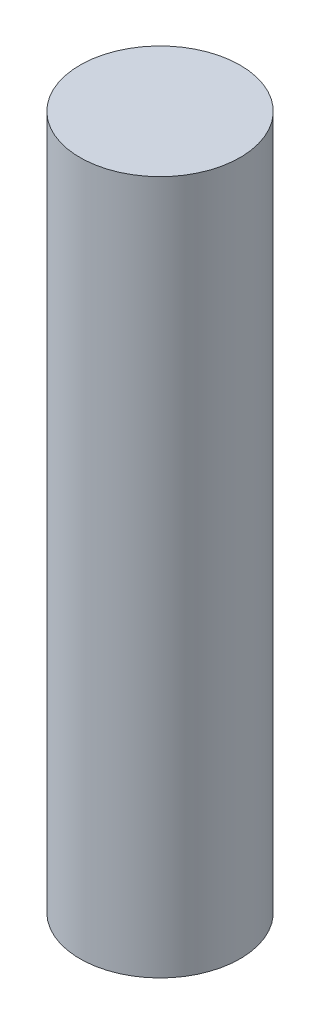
SolidWorks part; units mm, degrees
ref_plane "Front Plane" through (0, 0, 0) normal (0, 0, 1) x (1, 0, 0)
ref_plane "Top Plane" through (0, 0, 0) normal (0, 1, 0) x (1, 0, 0)
ref_plane "Right Plane" through (0, 0, 0) normal (1, 0, 0) x (0, 0, -1)
sketch "Sketch1" plane through (0, 0, 0) normal (0, 1, 0) x (1, 0, 0)
  circle A0 centre (-16897.0588, 3176.4706) radius 3
  dimension "D1" = 6
extrude "Boss-Extrude1" add sketch "Sketch1" along normal blind 26 contours A0
